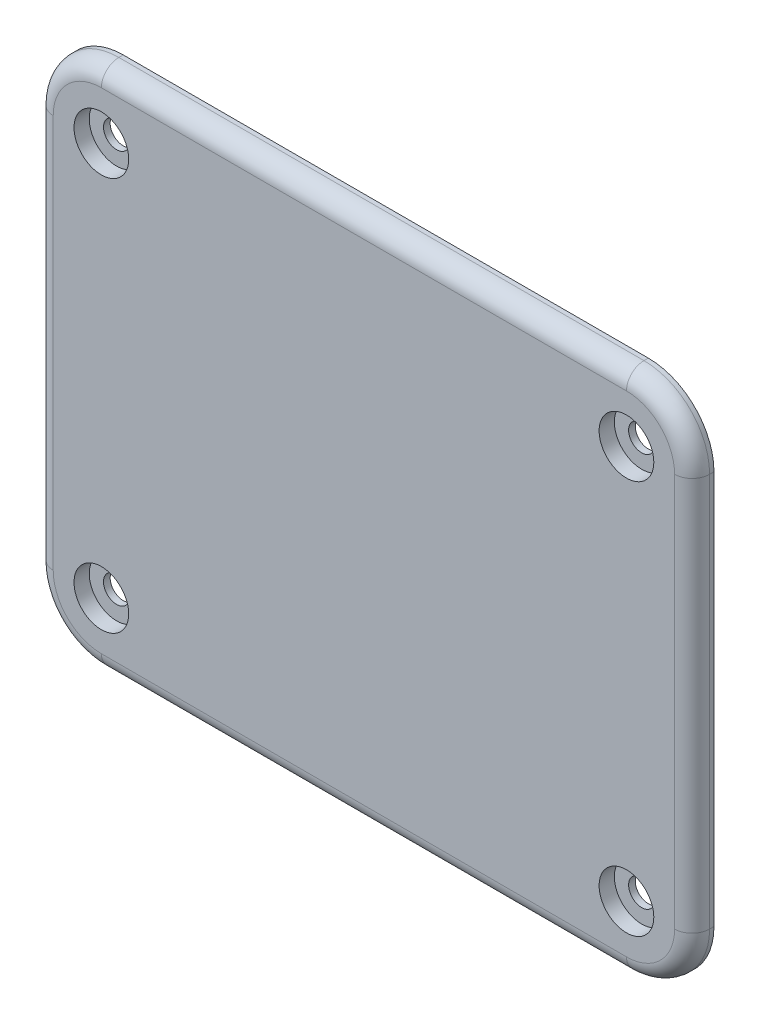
SolidWorks part; units mm, degrees
ref_plane "Front" through (0, 0, 0) normal (0, 0, 1) x (1, 0, 0)
ref_plane "Top" through (0, 0, 0) normal (0, 1, 0) x (1, 0, 0)
ref_plane "Right" through (0, 0, 0) normal (1, 0, 0) x (0, 0, -1)
sketch "Sketch1" plane through (0, 0, 0) normal (0, 0, 1) x (1, 0, 0)
  line L4 (38.1, 107.95) -> (-38.1, 107.95)
  line L5 (-47.625, 98.425) -> (-47.625, 41.275)
  line L6 (-38.1, 31.75) -> (38.1, 31.75)
  line L7 (47.625, 41.275) -> (47.625, 98.425)
  line L8 (38.1, 107.95) -> (-38.1, 107.95)
  line L9 (-47.625, 98.425) -> (-47.625, 41.275)
  line L10 (-38.1, 31.75) -> (38.1, 31.75)
  line L11 (47.625, 41.275) -> (47.625, 98.425)
  arc A4 (-38.1, 107.95) -> (-47.625, 98.425) centre (-38.1, 98.425) ccw
  arc A5 (-47.625, 41.275) -> (-38.1, 31.75) centre (-38.1, 41.275) ccw
  arc A6 (38.1, 31.75) -> (47.625, 41.275) centre (38.1, 41.275) ccw
  arc A7 (47.625, 98.425) -> (38.1, 107.95) centre (38.1, 98.425) ccw
  arc A8 (-38.1, 107.95) -> (-47.625, 98.425) centre (-38.1, 98.425) ccw
  arc A9 (-47.625, 41.275) -> (-38.1, 31.75) centre (-38.1, 41.275) ccw
  arc A10 (38.1, 31.75) -> (47.625, 41.275) centre (38.1, 41.275) ccw
  arc A11 (47.625, 98.425) -> (38.1, 107.95) centre (38.1, 98.425) ccw
  dimension "D1" = 0
extrude "Base-Extrude" add sketch "Sketch1" along normal blind 3.175
hole_wizard "CBORE for #6 Binding Head Machine Screw1" positions "Sketch3" profile "Sketch2" counterbore size "#6" standard "Ansi Inch"
sketch "Sketch3" plane through (0, 0, 3.175) normal (0, 0, 1) x (1, 0, 0)
  point P0 (-38.1, 98.425)
  point P1 (38.1, 98.425)
  point P3 (38.1, 41.275)
  point P5 (-38.1, 41.275)
sketch "Sketch2" plane through (-38.1, 98.425, 3.175) normal (1, 0, 0) x (0, -1, 0)
  line L0 (0, 0) -> (0, 3.175)
  line L1 (0, 3.175) -> (1.8986, 3.175)
  line L3 (1.8986, 3.175) -> (1.8986, 2.2098)
  line L4 (1.8986, 2.2098) -> (3.9688, 2.2098)
  line L5 (3.9688, 2.2098) -> (3.9688, 0)
  line L7 (3.9688, 0) -> (0, 0)
  line L11 (0, -6.35) -> (0, 107.95) construction
  dimension "Thru Hole Dia." = 3.7973
  dimension "Thru Hole Depth" = 3.175
  dimension "C'Bore Dia." = 7.9375
  dimension "C'Bore Depth" = 2.2098
fillet "Fillet1" radius 2.54 8 edges at (-44.8352, 105.1602, 3.175) (-47.625, 69.85, 3.175) (-44.8352, 34.5398, 3.175) (0, 31.75, 3.175) (44.8352, 34.5398, 3.175) (47.625, 69.85, 3.175) (44.8352, 105.1602, 3.175) (0, 107.95, 3.175)
